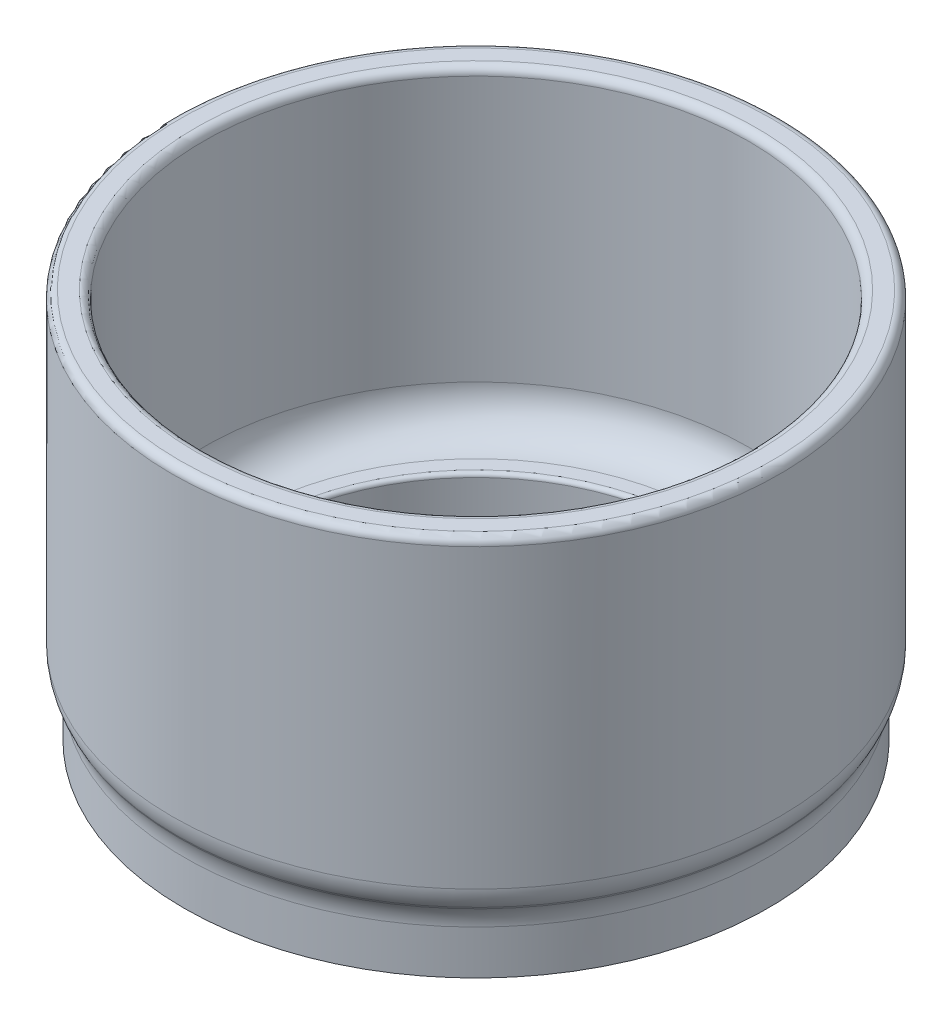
SolidWorks part; units mm, degrees
ref_plane "Front" through (0, 0, 0) normal (0, 0, 1) x (1, 0, 0)
ref_plane "Top" through (0, 0, 0) normal (0, 1, 0) x (1, 0, 0)
ref_plane "Right" through (0, 0, 0) normal (1, 0, 0) x (0, 0, -1)
sketch "Sketch1" plane through (0, 0, 0) normal (0, 1, 0) x (1, 0, 0)
  circle A0 centre (0, 0) radius 27.75
  circle A1 centre (0, 0) radius 37.5
  dimension "D1" = 55.5
  dimension "D2" = 75
extrude "Boss-Extrude1" add sketch "Sketch1" along normal blind 10
ref_plane "Plane1" through (0, 50, 0) normal (0, 1, 0) x (1, 0, 0)
sketch "Sketch2" plane through (0, 50, 0) normal (0, 1, 0) x (1, 0, 0)
  circle A0 centre (0, 0) radius 39
  circle A2 centre (0, 0) radius 35
  dimension "D1" = 78
  dimension "D2" = 70
extrude "Boss-Extrude2" add sketch "Sketch2" against normal up to surface (40 mm away)
chamfer "Chamfer1" distance 3 angle 30 1 edges at (0, 10, 37.5)
fillet "Fillet1" radius 1 2 edges at (0, 50, 35) (0, 50, 39)
fillet "Fillet3" radius 5 1 edges at (0, 10, 35)
fillet "Fillet4" radius 5 2 edges at (0, 7, 37.5) (0, 9.5981, 39)
fillet "Fillet5" radius 0.5 1 edges at (0, 10, 27.75)
sketch "Sketch3" plane through (0, 0, 0) normal (0, -1, 0) x (1, 0, 0)
  circle A0 centre (0, 0) radius 30.6287 construction
  text T0 "DR. MAD THRUST, PHD, MD, DDS, JD, DD" font "Century Gothic" height 3.175
extrude "Cut-Extrude1" cut sketch "Sketch3" against normal blind 0.5
